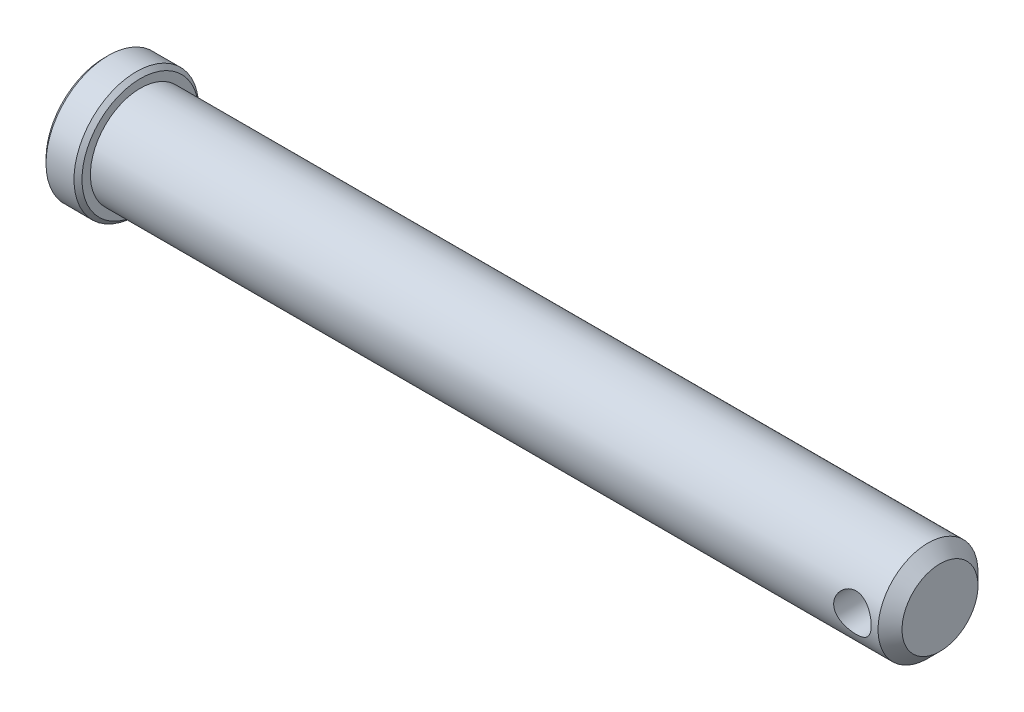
SolidWorks part; units mm, degrees
ref_plane "Plane1" through (0, 0, 0) normal (0, 0, 1) x (1, 0, 0)
ref_plane "Plane2" through (0, 0, 0) normal (0, 1, 0) x (1, 0, 0)
ref_plane "Plane3" through (0, 0, 0) normal (1, 0, 0) x (0, 0, -1)
sketch "Sketch1" plane through (0, 0, 0) normal (0, 0, 1) x (1, 0, 0)
  line L0 (0, 0) -> (0, 3.9624)
  line L1 (0, 3.9624) -> (2.286, 3.9624)
  line L2 (2.286, 3.9624) -> (2.286, 3.175)
  line L3 (2.286, 3.175) -> (53.086, 3.175)
  line L4 (53.086, 3.175) -> (53.086, 0)
  line L5 (53.086, 0) -> (0, 0)
  line L6 (0, 0) -> (-1.8299, 0) construction
  dimension "D1" = 3.175
  dimension "D2" = 2.286
  dimension "D3" = 3.9624
  dimension "D4" = 50.8
revolve "Base-Revolve" add sketch "Sketch1" angle 360 about L6
sketch "Sketch2" plane through (0, 0, 0) normal (0, 0, 1) x (1, 0, 0)
  line L0 (0, 0) -> (50.6984, 0) construction
  line L1 (53.086, -3.175) -> (53.086, 3.175) construction
  circle A0 centre (50.6984, 0) radius 1.1938
  dimension "D2" = 2.3876
  dimension "D1" = 2.3876
extrude "Cut-Extrude1" cut sketch "Sketch2" against normal through all and the other way through all
chamfer "Chamfer1" distance 0.762 angle 45
chamfer "Chamfer2" distance 0.254 angle 45
